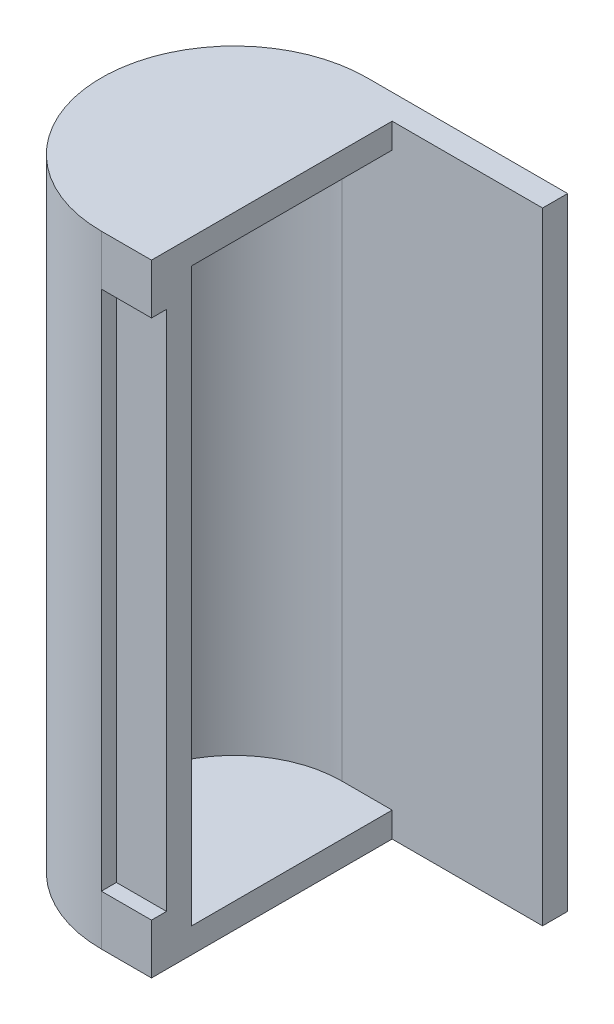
SolidWorks part; units mm, degrees
ref_plane "Front Plane" through (0, 0, 0) normal (0, 0, 1) x (1, 0, 0)
ref_plane "Top Plane" through (0, 0, 0) normal (0, 1, 0) x (1, 0, 0)
ref_plane "Right Plane" through (0, 0, 0) normal (1, 0, 0) x (0, 0, -1)
sketch "Sketch1" plane through (0, 0, 0) normal (0, 0, 1) x (1, 0, 0)
  line L1 (-24.3261, 14.4056) -> (15.6739, 14.4056)
  line L2 (-24.3261, 14.4056) -> (-24.3261, -109.5944)
  line L3 (-24.3261, -109.5944) -> (15.6739, -109.5944)
  line L4 (15.6739, 14.4056) -> (15.6739, -109.5944)
  dimension "D1" = 40
  dimension "D2" = 124
extrude "Boss-Extrude1" add sketch "Sketch1" along normal blind 5
sketch "Sketch6" plane through (0, 14.4056, 0) normal (0, 1, 0) x (1, 0, 0)
  line L0 (-24.3261, 8.1681) -> (-24.3261, -31.7755) construction
  line L1 (-54.6867, -48) -> (31.1641, -48) construction
  line L2 (15.6739, -5) -> (-24.3261, -5) construction
  line L3 (-24.3261, -31.7755) -> (-24.3261, -77.0579) construction
  line L4 (-54.6867, -53) -> (51.2477, -53) construction
  line L5 (15.6739, 0) -> (-24.3261, 0) construction
  line L6 (-24.3261, -48) -> (-24.3261, -53)
  line L11 (15.6739, 0) -> (-24.3261, 0)
  line L12 (-24.3261, 0) -> (-24.3261, -5)
  line L13 (-24.3261, -5) -> (15.6739, -5)
  line L14 (15.6739, -5) -> (15.6739, 0)
  line L15 (15.6739, 0) -> (-24.3261, 0)
  line L17 (-24.3261, -5) -> (15.6739, -5)
  line L18 (15.6739, -5) -> (15.6739, 0)
  arc A0 (-24.3261, -5) -> (-24.3261, -48) centre (-24.3261, -26.5) ccw
  arc A1 (-24.3261, 0) -> (-24.3261, -53) centre (-24.3261, -26.5) ccw
  dimension "D1" = 43
  dimension "D2" = 53
  dimension "D3" = 0
extrude "Boss-Extrude3" add sketch "Sketch6" against normal blind 124
sketch "Sketch7" plane through (-24.3261, 0, 0) normal (1, 0, 0) x (0, 0, -1)
  line L1 (-53, 14.4056) -> (-48, 14.4056)
  line L2 (-53, 14.4056) -> (-53, -109.5944)
  line L3 (-53, -109.5944) -> (-48, -109.5944)
  line L4 (-48, 14.4056) -> (-48, -109.5944)
extrude "Boss-Extrude4" add sketch "Sketch7" along normal blind 10
sketch "Sketch8" plane through (0, 0, 53) normal (0, 0, 1) x (1, 0, 0)
  line L0 (-24.3261, -109.5944) -> (-24.3261, 14.4056) construction
  line L1 (-24.3261, 4.4056) -> (-14.3261, 4.4056)
  line L2 (-24.3261, 4.4056) -> (-24.3261, -99.5944)
  line L3 (-24.3261, -99.5944) -> (-14.3261, -99.5944)
  line L4 (-14.3261, 4.4056) -> (-14.3261, -99.5944)
  line L5 (-14.3261, 14.4056) -> (-14.3261, -109.5944) construction
  line L6 (-14.3261, 14.4056) -> (-24.3261, 14.4056) construction
  line L7 (-14.3261, -109.5944) -> (-24.3261, -109.5944) construction
  dimension "D1" = 10
  dimension "D2" = 10
extrude "Cut-Extrude1" cut sketch "Sketch8" against normal blind 5
sketch "Sketch9" plane through (0, 0, 0) normal (0, 0, -1) x (-1, 0, 0)
  line L1 (24.3261, 14.4056) -> (14.3261, 14.4056)
  line L2 (24.3261, 14.4056) -> (24.3261, -109.5944)
  line L3 (24.3261, -109.5944) -> (14.3261, -109.5944)
  line L4 (14.3261, 14.4056) -> (14.3261, -109.5944)
sketch "Sketch10" plane through (0, 0, 53) normal (0, 0, 1) x (1, 0, 0)
  line L1 (-24.3261, 14.4056) -> (-14.3261, 14.4056)
  line L2 (-24.3261, 14.4056) -> (-24.3261, -109.5944)
  line L3 (-24.3261, -109.5944) -> (-14.3261, -109.5944)
  line L4 (-14.3261, 14.4056) -> (-14.3261, -109.5944)
extrude "Boss-Extrude6" add sketch "Sketch10" against normal blind 8
sketch "Sketch11" plane through (0, 0, 53) normal (0, 0, 1) x (1, 0, 0)
  line L1 (-24.3261, 4.4056) -> (-14.3261, 4.4056)
  line L2 (-24.3261, 4.4056) -> (-24.3261, -99.5944)
  line L3 (-24.3261, -99.5944) -> (-14.3261, -99.5944)
  line L4 (-14.3261, 4.4056) -> (-14.3261, -99.5944)
extrude "Cut-Extrude5" cut sketch "Sketch11" along normal blind 4 and the other way blind 3
sketch "Sketch12" plane through (0, 14.4056, 0) normal (0, 1, 0) x (1, 0, 0)
  line L0 (-14.3261, -53) -> (-14.3261, 0)
  line L1 (15.6739, 0) -> (-24.3261, 0) construction
  line L2 (-14.3261, 0) -> (-24.3261, 0)
  line L3 (-14.3261, -53) -> (-24.3261, -53)
  arc A0 (-24.3261, 0) -> (-24.3261, -53) centre (-24.3261, -26.5) ccw
extrude "Boss-Extrude7" add sketch "Sketch12" against normal blind 5
sketch "Sketch13" plane through (0, -109.5944, 0) normal (0, -1, 0) x (1, 0, 0)
  line L0 (-24.3261, 53) -> (-14.3261, 53)
  line L1 (-14.3261, 53) -> (-14.3261, 0)
  line L2 (15.6739, 0) -> (-24.3261, 0) construction
  line L3 (-14.3261, 0) -> (-24.3261, 0)
  arc A0 (-24.3261, 53) -> (-24.3261, 0) centre (-24.3261, 26.5) ccw
extrude "Boss-Extrude8" add sketch "Sketch13" against normal blind 5
